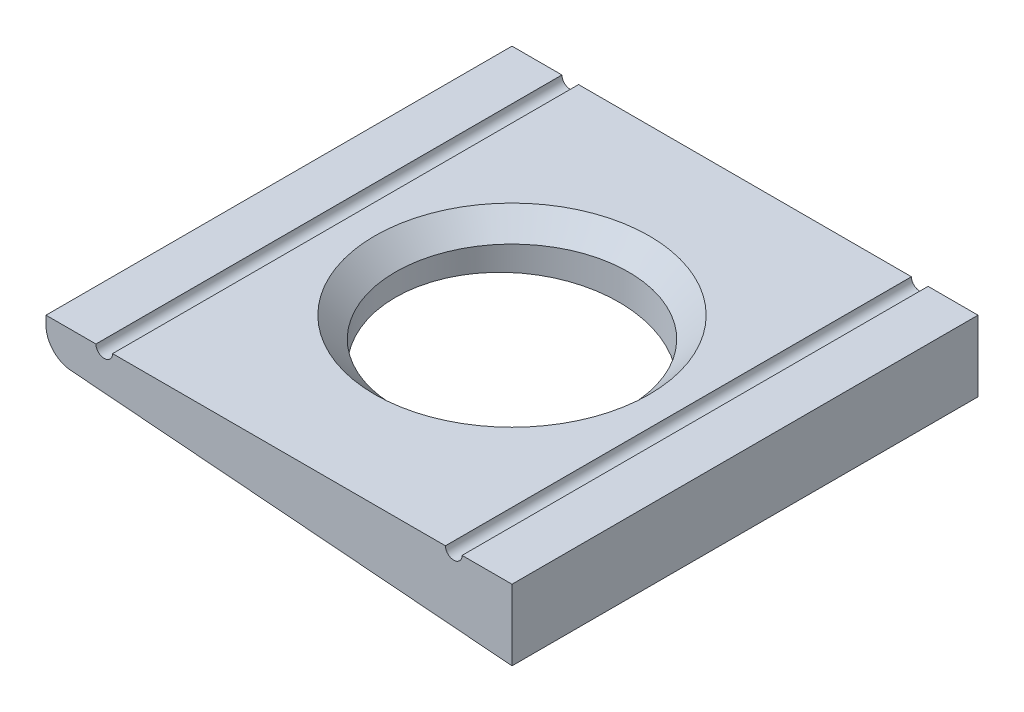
SolidWorks part; units mm, degrees
ref_plane "Plane1" through (0, 0, 0) normal (0, 0, 1) x (1, 0, 0)
ref_plane "Plane2" through (0, 0, 0) normal (0, 1, 0) x (1, 0, 0)
ref_plane "Plane3" through (0, 0, 0) normal (1, 0, 0) x (0, 0, -1)
sketch "Sketch1" plane through (0, 0, 0) normal (0, 0, 1) x (1, 0, 0)
  line L0 (28, 0) -> (-28, 0)
  line L1 (28, 0) -> (28, -8.5)
  line L2 (-28, 0) -> (-28, -1.0658)
  line L3 (28, -8.5) -> (-25.0552, -4.2556)
  line L4 (0, 0) -> (0, -6.26) construction
  arc A0 (-25.0552, -4.2556) -> (-28, -1.0658) centre (-24.8, -1.0658) cw
  dimension "R" = 3.2
  dimension "B" = 56
  dimension "D2" = 28
  dimension "H" = 8.5
  dimension "E" = 6.26
extrude "Base-Extrude" add sketch "Sketch1" along normal mid plane 56
sketch "Sketch2" plane through (0, 0, 0) normal (0, 1, 0) x (-1, 0, 0)
  circle A0 centre (0, 0) radius 14
  dimension "D" = 28
extrude "Cut-Extrude1" cut sketch "Sketch2" against normal through all
sketch "Sketch3" plane through (0, 0, 28) normal (0, 0, 1) x (1, 0, 0)
  line L0 (28, 0) -> (-28, 0) construction
  circle A0 centre (21, 0) radius 1
  circle A1 centre (-21, 0) radius 1
  dimension "D1" = 1
  dimension "T" = 1
  dimension "D2" = 21
  dimension "D3" = 21
extrude "ID-Grooves" cut sketch "Sketch3" against normal through all
chamfer "Chamfer1" distance 2.5 angle 45 1 edges at (-14, 0, 0)
equation "\"D2@Sketch1\" = \"B@Sketch1\" / 2"
equation "\"D2@Sketch3\" =  ( \"D@Sketch2\" / 2 )  +  ( \"B@Sketch1\" -  \"D@Sketch2\" )  / 4"
equation "\"D3@Sketch3\" = \"D2@Sketch3\""
equation "\"D1@Sketch3\" = \"T@Sketch3\""
